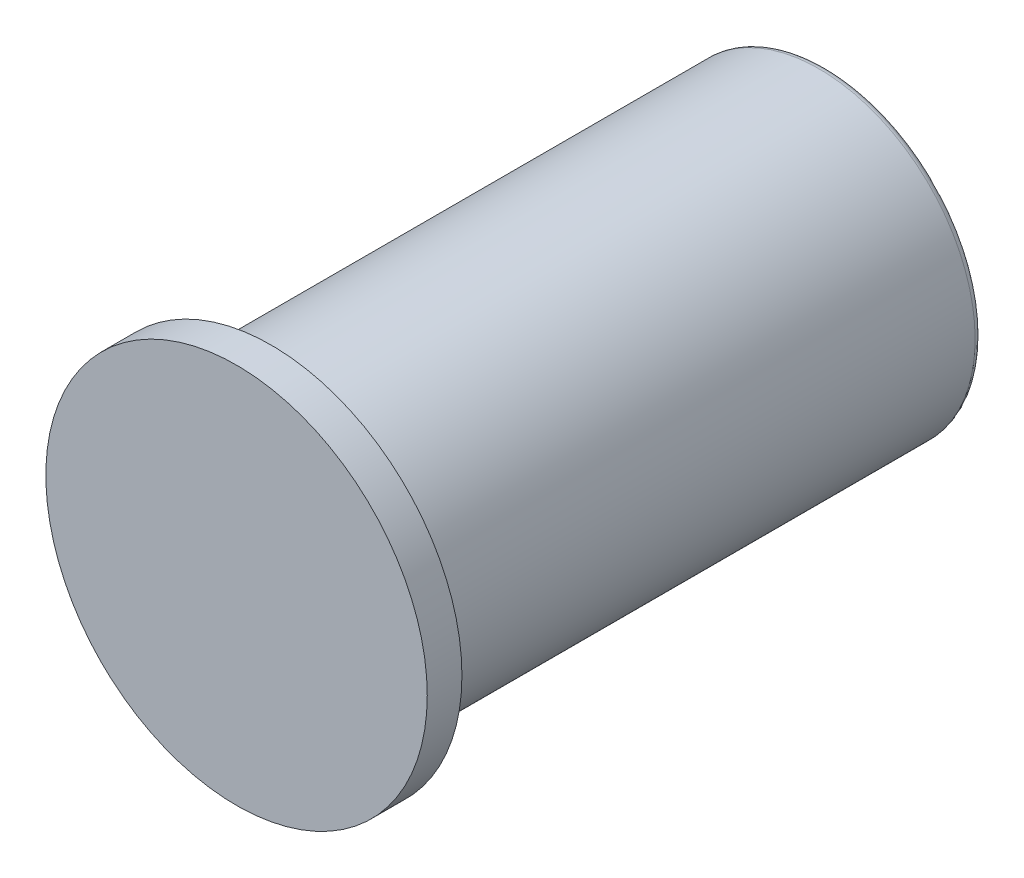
SolidWorks part; units mm, degrees
ref_plane "Front Plane" through (0, 0, 0) normal (0, 0, 1) x (1, 0, 0)
ref_plane "Top Plane" through (0, 0, 0) normal (0, 1, 0) x (1, 0, 0)
ref_plane "Right Plane" through (0, 0, 0) normal (1, 0, 0) x (0, 0, -1)
sketch "Sketch1" plane through (0, 0, 0) normal (1, 0, 0) x (0, 0, -1)
  line L0 (0, 0) -> (170, 0) construction
  line L1 (170, 0) -> (170, 43)
  line L2 (168, 45) -> (10, 45)
  line L3 (10, 45) -> (10, 55)
  line L4 (10, 55) -> (0, 55)
  line L5 (0, 55) -> (0, 0)
  line L6 (0, 0) -> (170, 0)
  arc A0 (170, 43) -> (168, 45) centre (168, 43) ccw
  dimension "D5" = 2
  dimension "D1" = 90
  dimension "D2" = 110
  dimension "D3" = 10
  dimension "D4" = 160
revolve "Revolve1" add sketch "Sketch1" angle 360 about L0
hole_wizard "M8 Tapped Hole1" positions "Sketch4" profile "Sketch3" tap size "M8" standard "ISO"
sketch "Sketch4" plane through (0, 0, -170) normal (0, 0, -1) x (-1, 0, 0)
  point P0 (0, 0)
sketch "Sketch3" plane through (0, 0, -170) normal (1, 0, 0) x (0, 1, 0)
  line L0 (0, 0) -> (0, 21.7929)
  line L1 (0, 21.7929) -> (3.4, 19.75)
  line L2 (3.4, 19.75) -> (3.4, 1.1)
  line L3 (3.4, 1.1) -> (4.5, 0)
  line L5 (4.5, 0) -> (0, 0)
  line L6 (-3.4, 1.1) -> (-4.5, 0) construction
  line L10 (0, 21.7929) -> (-3.4, 19.75) construction
  line L11 (0, -6.35) -> (0, 107.95) construction
  dimension "Tap Drill Dia." = 6.8
  dimension "Tap Drill Depth" = 19.75
  dimension "Near C'Sink Dia." = 9
  dimension "Near C'Sink Angle" = 90
  dimension "Drill Angle" = 118
